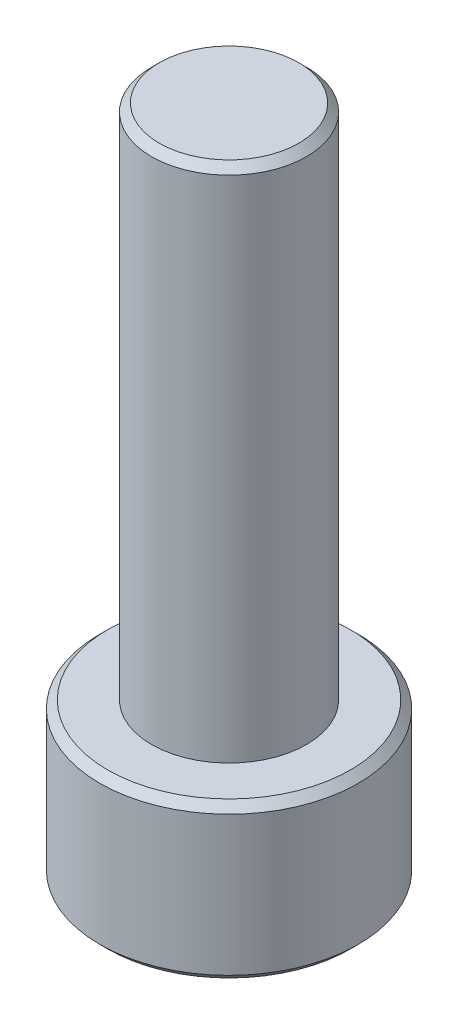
SolidWorks part; units mm, degrees
ref_plane "Front" through (0, 0, 0) normal (0, 0, 1) x (1, 0, 0)
ref_plane "Top" through (0, 0, 0) normal (0, 1, 0) x (1, 0, 0)
ref_plane "Right" through (0, 0, 0) normal (1, 0, 0) x (0, 0, -1)
sketch "Sketch1" plane through (0, 0, 0) normal (0, 1, 0) x (1, 0, 0)
  circle A0 centre (0, 0) radius 5
  dimension "D1" = 10
extrude "Boss-Extrude1" add sketch "Sketch1" along normal blind 6
sketch "Sketch2" plane through (0, 6, 0) normal (0, 1, 0) x (1, 0, 0)
  circle A0 centre (0, 0) radius 3
  dimension "D1" = 6
extrude "Boss-Extrude2" add sketch "Sketch2" along normal blind 20
chamfer "Chamfer1" distance 0.3 angle 45 2 edges at (0, 0, 5) (0, 6, 5)
chamfer "Chamfer2" distance 0.3 angle 45 1 edges at (0, 26, 3)
sketch "Sketch3" plane through (0, 0, 0) normal (0, -1, 0) x (1, 0, 0)
  line L1 (2.8868, 0) -> (1.4434, 2.5)
  line L2 (1.4434, 2.5) -> (-1.4434, 2.5)
  line L3 (-1.4434, 2.5) -> (-2.8868, 0)
  line L4 (-2.8868, 0) -> (-1.4434, -2.5)
  line L5 (-1.4434, -2.5) -> (1.4434, -2.5)
  line L6 (1.4434, -2.5) -> (2.8868, 0)
  circle A0 centre (0, 0) radius 2.5 construction
  dimension "D1" = 5
extrude "Cut-Extrude1" cut sketch "Sketch3" against normal blind 3
